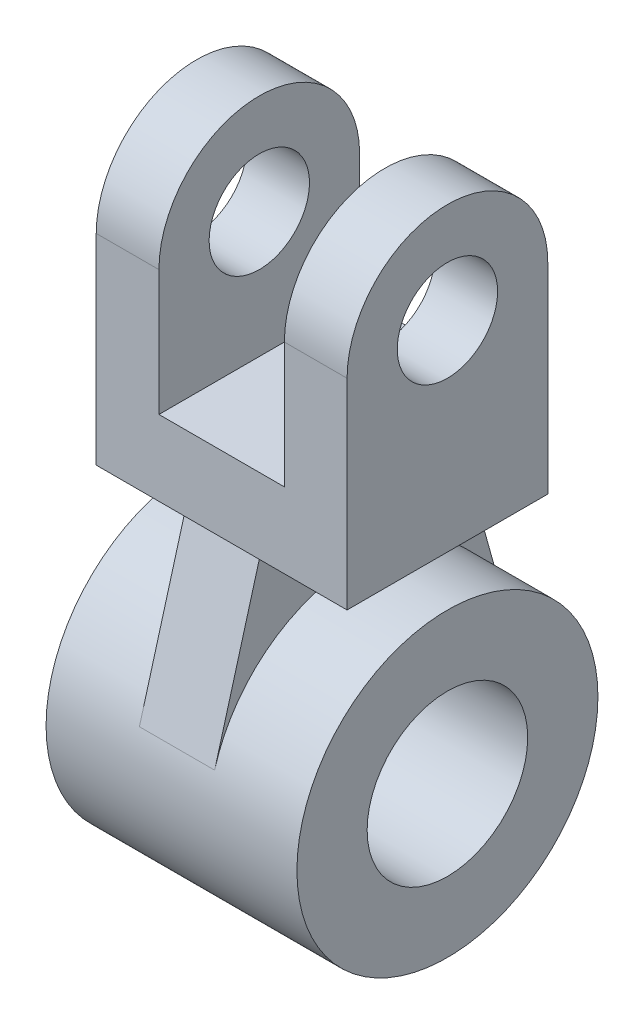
SolidWorks part; units mm, degrees
ref_plane "Front Plane" through (0, 0, 0) normal (0, 0, 1) x (1, 0, 0)
ref_plane "Top Plane" through (0, 0, 0) normal (0, 1, 0) x (1, 0, 0)
ref_plane "Right Plane" through (0, 0, 0) normal (1, 0, 0) x (0, 0, -1)
sketch "Sketch1" plane through (0, 0, 0) normal (1, 0, 0) x (0, 0, -1)
  circle A0 centre (0, 0) radius 30
  dimension "D1" = 60
extrude "Boss-Extrude1" add sketch "Sketch1" against normal blind 50
sketch "Sketch2" plane through (0, 0, 0) normal (1, 0, 0) x (0, 0, -1)
  circle A0 centre (0, 0) radius 16
  dimension "D1" = 32
extrude "Cut-Extrude1" cut sketch "Sketch2" against normal through all
sketch "Sketch3" plane through (0, 0, 0) normal (1, 0, 0) x (0, 0, -1)
  line L0 (0, 0) -> (0, 80) construction
  line L1 (0, 100) -> (0, 40) construction
  line L2 (-20, 80) -> (-20, 40)
  line L3 (20, 80) -> (20, 40)
  line L4 (-20, 40) -> (20, 40)
  line L5 (20, 40) -> (20.9125, 39.6052)
  arc A0 (20, 80) -> (-20, 80) centre (0, 80) ccw
  dimension "D2" = 40
  dimension "D1" = 80
extrude "Boss-Extrude2" add sketch "Sketch3" against normal blind 12.5 separate body contours L3 A0 L2 L4
sketch "Sketch4" plane through (0, 0, 0) normal (1, 0, 0) x (0, 0, -1)
  circle A0 centre (0, 80) radius 10
  dimension "D1" = 20
extrude "Cut-Extrude2" cut sketch "Sketch4" against normal blind 12.5
sketch "Sketch5" plane through (-50, 0, 0) normal (-1, 0, 0) x (0, 0, 1)
  line L0 (0, 0) -> (0, 80) construction
  line L1 (-20, 80) -> (-20, 40)
  line L2 (-20, 40) -> (20, 40)
  line L3 (20, 40) -> (20, 80)
  arc A0 (20, 80) -> (-20, 80) centre (0, 80) ccw
extrude "Boss-Extrude3" add sketch "Sketch5" against normal blind 12.5 separate body
sketch "Sketch6" plane through (-50, 0, 0) normal (-1, 0, 0) x (0, 0, 1)
  circle A0 centre (0, 80) radius 10
  dimension "D1" = 20
extrude "Cut-Extrude3" cut sketch "Sketch6" against normal blind 12.5
sketch "Sketch7" plane through (0, 0, 20) normal (0, 0, 1) x (1, 0, 0)
  line L0 (-37.5, 40) -> (-37.5, 55)
  line L1 (-37.5, 40) -> (-37.5, 80) construction
  line L2 (-37.5, 55) -> (-12.5, 55)
  line L3 (-12.5, 80) -> (-12.5, 40) construction
  line L4 (-12.5, 55) -> (-12.5, 40)
  line L5 (-12.5, 40) -> (-37.5, 40)
  dimension "D1" = 15
extrude "Boss-Extrude4" add sketch "Sketch7" against normal blind 40
ref_plane "Plane1" through (-25, 0, 0) normal (-1, 0, 0) x (0, 0, 1)
sketch "Sketch8" plane through (-25, 0, 0) normal (-1, 0, 0) x (0, 0, 1)
  line L0 (-20, 40) -> (-28.8997, 8.0501)
  line L1 (-20, 40) -> (20, 40)
  line L2 (20, 40) -> (28.8997, 8.0501)
  circle A0 centre (0, 0) radius 30 construction
  arc A1 (28.8997, 8.0501) -> (-28.8997, 8.0501) centre (0, 0) ccw
extrude "Boss-Extrude5" add sketch "Sketch8" along normal mid plane 15
